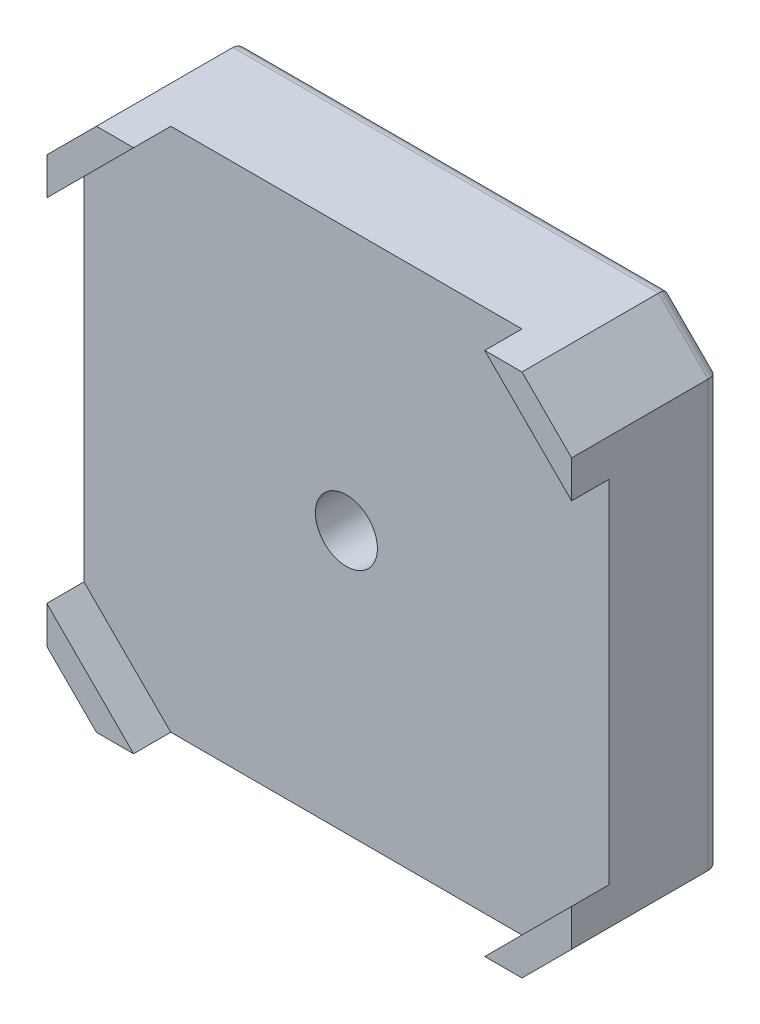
SolidWorks part; units mm, degrees
ref_plane "Plan de face" through (0, 0, 0) normal (0, 0, 1) x (1, 0, 0)
ref_plane "Plan de dessus" through (0, 0, 0) normal (0, 1, 0) x (1, 0, 0)
ref_plane "Plan de droite" through (0, 0, 0) normal (1, 0, 0) x (0, 0, -1)
sketch "Esquisse1" plane through (0, 0, 0) normal (0, 0, 1) x (1, 0, 0)
  line L0 (-21.15, 17.15) -> (-17.15, 21.15)
  line L1 (-17.15, 21.15) -> (17.15, 21.15)
  line L2 (-21.15, 17.15) -> (-21.15, -17.15)
  line L3 (-17.15, -21.15) -> (17.15, -21.15)
  line L4 (21.15, 17.15) -> (21.15, -17.15)
  line L5 (-21.15, 21.15) -> (21.15, -21.15) construction
  line L6 (-21.15, -21.15) -> (21.15, 21.15) construction
  line L7 (-21.15, -17.15) -> (-17.15, -21.15)
  line L8 (17.15, -21.15) -> (21.15, -17.15)
  line L9 (17.15, 21.15) -> (21.15, 17.15)
  point P0 (0, 0)
  dimension "D1" = 42.3
extrude "Boss.-Extru.1" add sketch "Esquisse1" along normal blind 12
sketch "Esquisse2" plane through (0, 0, 12) normal (0, 0, 1) x (1, 0, 0)
  line L0 (-21.15, 14.15) -> (-14.15, 21.15)
  line L1 (-14.15, 21.15) -> (14.15, 21.15)
  line L2 (-21.15, 14.15) -> (-21.15, -14.15)
  line L3 (-14.15, -21.15) -> (14.15, -21.15)
  line L4 (21.15, 14.15) -> (21.15, -14.15)
  line L5 (-21.15, 21.15) -> (21.15, -21.15) construction
  line L6 (-21.15, -21.15) -> (21.15, 21.15) construction
  line L7 (14.15, 21.15) -> (21.15, 14.15)
  line L8 (21.15, -14.15) -> (14.15, -21.15)
  line L9 (-21.15, -14.15) -> (-14.15, -21.15)
  point P0 (0, 0)
  dimension "D1" = 42.3
extrude "Enlèv. mat.-Extru.1" cut sketch "Esquisse2" against normal blind 3
sketch "Esquisse3" plane through (0, 0, 0) normal (0, 0, -1) x (-1, 0, 0)
  circle A0 centre (0, 0) radius 11
  dimension "D1" = 22
extrude "Boss.-Extru.2" add sketch "Esquisse3" along normal blind 2
sketch "Esquisse4" plane through (0, 0, -2) normal (0, 0, -1) x (-1, 0, 0)
  circle A0 centre (0, 0) radius 5.5
  dimension "D1" = 11
extrude "Enlèv. mat.-Extru.2" cut sketch "Esquisse4" against normal blind 7
sketch "Esquisse5" plane through (0, 0, 5) normal (0, 0, -1) x (-1, 0, 0)
  circle A0 centre (0, 0) radius 2.5
  dimension "D1" = 5
extrude "Enlèv. mat.-Extru.3" cut sketch "Esquisse5" against normal through all
fillet "Congé1" radius 1 8 edges at (-19.15, 19.15, 0) (-21.15, 0, 0) (-19.15, -19.15, 0) (0, -21.15, 0) (19.15, -19.15, 0) (21.15, 0, 0) (19.15, 19.15, 0) (0, 21.15, 0)
fillet "Congé2" radius 0.5 3 edges at (-5.5, 0, -2) (-5.5, 0, 5) (-11, 0, -2)
sketch "Esquisse6" plane through (0, 0, 0) normal (0, 0, -1) x (-1, 0, 0)
  line L1 (-15.5, -15.5) -> (15.5, -15.5) construction
  line L2 (-15.5, -15.5) -> (-15.5, 15.5) construction
  line L3 (-15.5, 15.5) -> (15.5, 15.5) construction
  line L4 (15.5, -15.5) -> (15.5, 15.5) construction
  line L5 (-15.5, -15.5) -> (15.5, 15.5) construction
  line L6 (-15.5, 15.5) -> (15.5, -15.5) construction
  circle A0 centre (-15.5, 15.5) radius 1.5
  circle A1 centre (15.5, 15.5) radius 1.5
  circle A2 centre (15.5, -15.5) radius 1.5
  circle A3 centre (-15.5, -15.5) radius 1.5
  point P0 (0, 0)
  dimension "D1" = 3
  dimension "D2" = 31
extrude "Enlèv. mat.-Extru.4" cut sketch "Esquisse6" against normal blind 3
fillet "Congé3" radius 0.5 4 edges at (14, 15.5, 0) (14, -15.5, 0) (-17, -15.5, 0) (-17, 15.5, 0)
